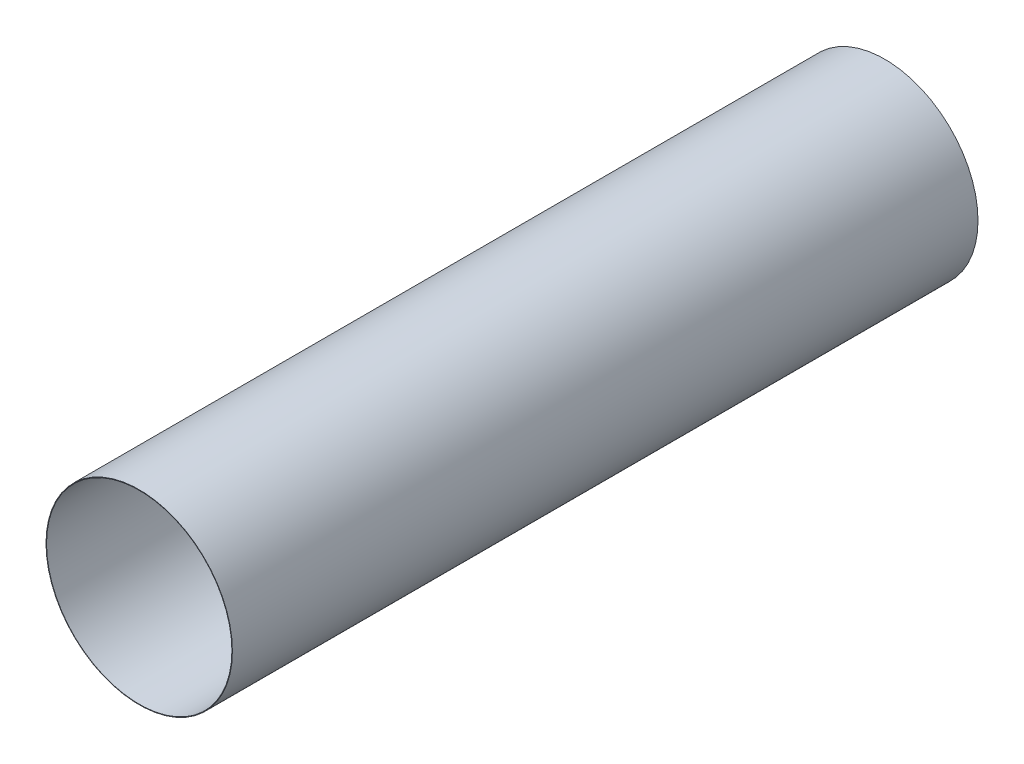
SolidWorks part; units mm, degrees
ref_plane "Front Plane" through (0, 0, 0) normal (0, 0, 1) x (1, 0, 0)
ref_plane "Top Plane" through (0, 0, 0) normal (0, 1, 0) x (1, 0, 0)
ref_plane "Right Plane" through (0, 0, 0) normal (1, 0, 0) x (0, 0, -1)
sketch "DuctSketch" plane through (0, 0, 0) normal (0, 0, 1) x (1, 0, 0)
  circle A0 centre (0, 0) radius 375
  circle A1 centre (0, 0) radius 373 construction
  dimension "InnerDiameter" = 746
  dimension "OuterDiameter" = 750
extrude "Extrusion" add sketch "DuctSketch" along normal blind 3000 thin
sketch "FilterSketch" plane through (0, 0, 0) normal (0, 0, 1) x (1, 0, 0)
  circle A0 centre (0, 0) radius 375 construction
  dimension "NominalDiameter" = 750
